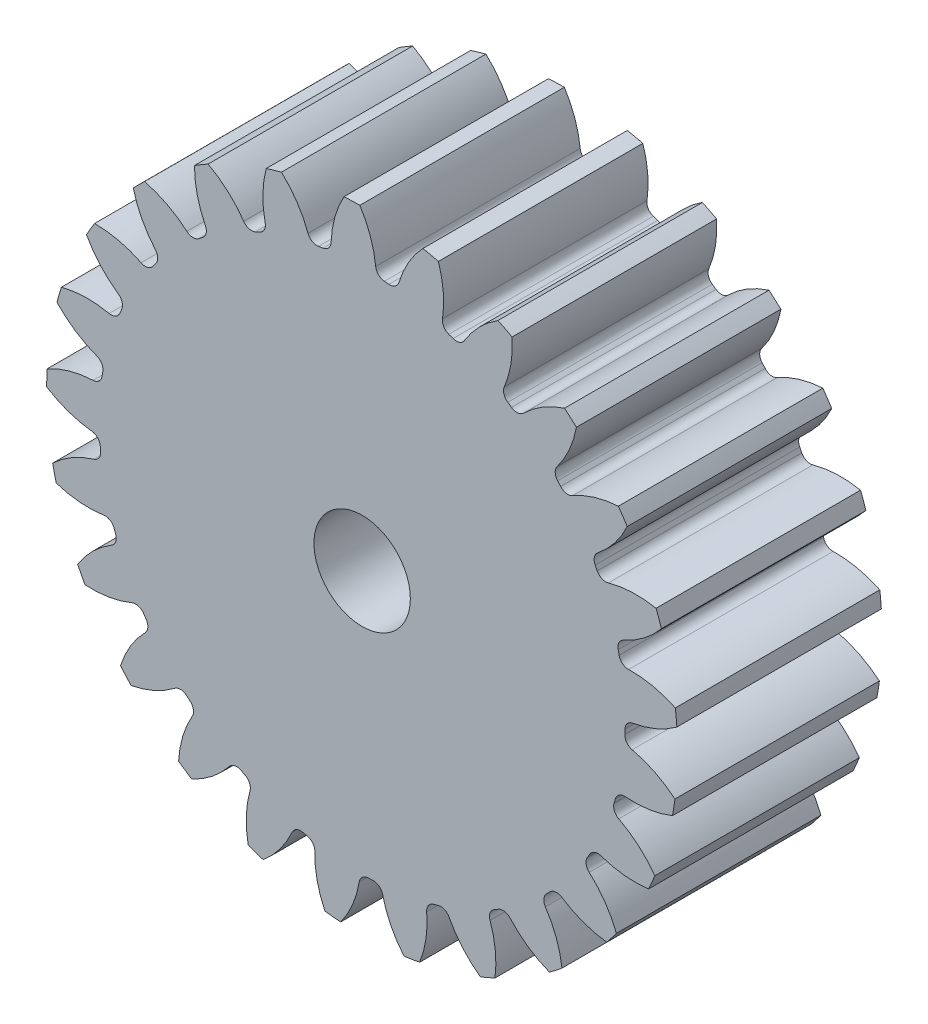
SolidWorks part; units mm, degrees
ref_plane "Front" through (0, 0, 0) normal (0, 0, 1) x (1, 0, 0)
ref_plane "Top" through (0, 0, 0) normal (0, 1, 0) x (1, 0, 0)
ref_plane "Right" through (0, 0, 0) normal (1, 0, 0) x (0, 0, -1)
sketch "Sketch3" plane through (0, 0, 0) normal (0, 0, 1) x (1, 0, 0)
  circle A0 centre (0, 0) radius 137.16
  dimension "od" = 274.32
extrude "gearBody" add sketch "Sketch3" along normal blind 88.9
sketch "Sketch2" plane through (0, 0, 0) normal (0, 0, 1) x (1, 0, 0)
  line L0 (0, 0) -> (110.2567, 45.6698) construction
  line L1 (136.3096, -18.1608) -> (0, 0) construction
  line L2 (0, 0) -> (36.3143, 0) construction
  line L3 (126.9337, 4.1022) -> (126.4514, -11.7915) construction
  line L5 (126.6926, -3.8446) -> (0, 0) construction
  line L7 (0, 0) -> (119.341, 0) construction
  arc A0 (119.3272, 1.8097) -> (118.9979, -9.0419) centre (0, 0) ccw construction
  arc A1 (136.8228, 9.6112) -> (135.9883, -17.8899) centre (0, 0) ccw construction
  arc A2 (126.9337, 4.1022) -> (126.4514, -11.7915) centre (0, 0) ccw construction
  arc A3 (114.2132, -4.4536) -> (114.2731, -2.4801) centre (0, 0) ccw
  arc A4 (136.3096, -18.1608) -> (117.4103, -8.6427) centre (107.2845, -52.2714) ccw
  arc A5 (136.3096, -18.1608) -> (137.16, 9.862) centre (0, 0) ccw
  arc A6 (137.16, 9.862) -> (117.7183, 1.5075) centre (110.2567, 45.6698) cw
  arc A7 (114.2731, -2.4801) -> (117.7183, 1.5075) centre (118.4072, -2.5699) cw
  arc A8 (117.4103, -8.6427) -> (114.2132, -4.4536) centre (118.3452, -4.6147) cw
  point P6 (137.16, 9.862)
  point P22 (136.3096, -18.1608)
  dimension "baseDia" = 238.6819
  dimension "od" = 274.32
  dimension "pd" = 254
  dimension "rd" = 228.6
  dimension "rFillet" = 4.1351
  dimension "pointX" = 137.16
  dimension "pointY" = 9.862
  dimension "CTT" = 15.8937
  dimension "flankCenterAngle" = 22.5
extrude "toothCut" cut sketch "Sketch2" along normal through all
pattern_circular "CirPattern1" count 25 over 360 about axis through (0, 0, 0) along (0, 0, 1) of "toothCut"
sketch "hub1Dia" plane through (0, 0, 0) normal (0, 0, -1) x (-1, 0, 0)
  circle A0 centre (0, 0) radius 12.7
  dimension "hub1Dia" = 25.4
sketch "hub2Dia" plane through (0, 0, 88.9) normal (0, 0, 1) x (1, 0, 0)
  circle A0 centre (0, 0) radius 12.7
  dimension "hub2dia" = 25.4
sketch "boreDia" plane through (0, 0, 0) normal (0, 0, 1) x (1, 0, 0)
  circle A0 centre (0, 0) radius 20.955
  dimension "boreDia" = 41.91
extrude "bore" cut sketch "boreDia" against normal mid plane 25400
